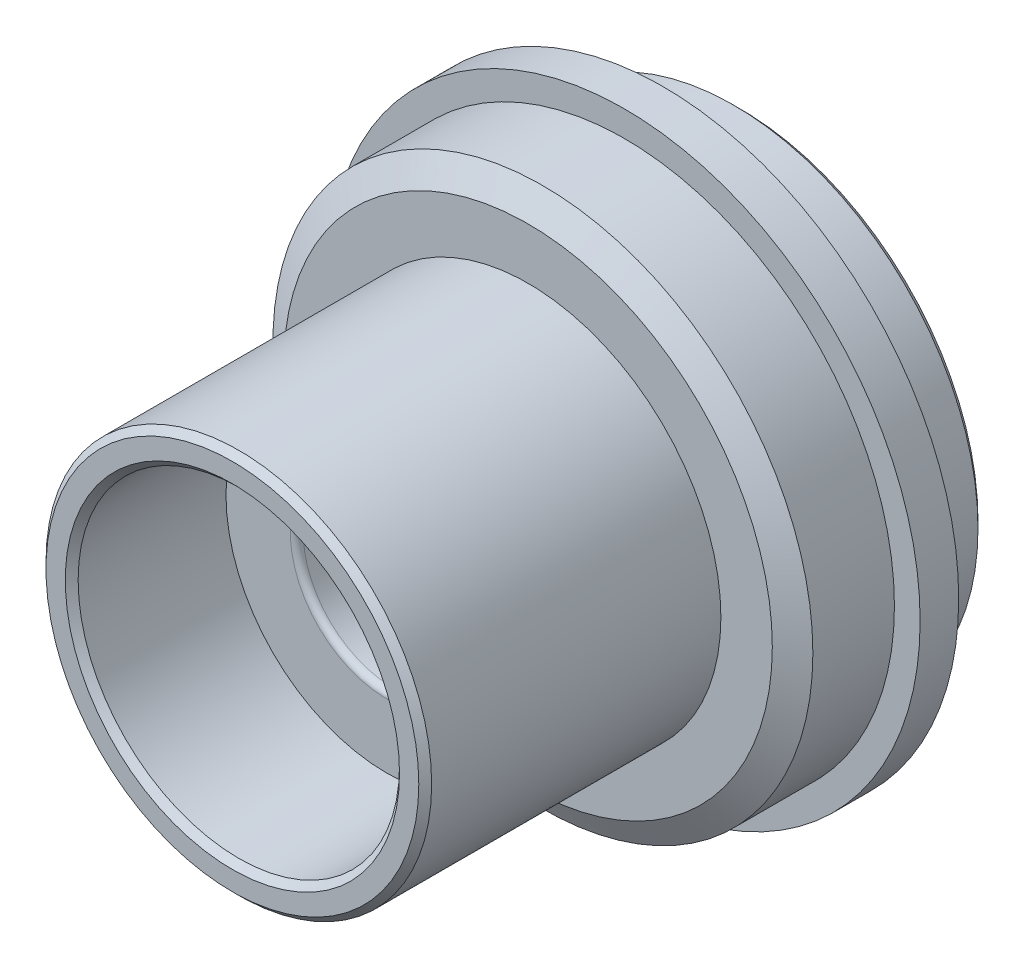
SolidWorks part; units mm, degrees
ref_plane "Plan1" through (0, 0, 0) normal (0, 0, 1) x (1, 0, 0)
ref_plane "Plan2" through (0, 0, 0) normal (0, 1, 0) x (1, 0, 0)
ref_plane "Plan3" through (0, 0, 0) normal (1, 0, 0) x (0, 0, -1)
sketch "Esquisse1" plane through (0, 0, 0) normal (0, 0, 1) x (1, 0, 0)
  circle A0 centre (0, 0) radius 19
  dimension "D1" = 38
extrude "Base-Extrusion" add sketch "Esquisse1" along normal blind 6
sketch "Esquisse2" plane through (0, 0, 6) normal (0, 0, 1) x (1, 0, 0)
  circle A0 centre (0, 0) radius 23
  dimension "D1" = 46
extrude "Boss.-Extru.1" add sketch "Esquisse2" along normal blind 3
sketch "Esquisse3" plane through (0, 0, 9) normal (0, 0, 1) x (1, 0, 0)
  circle A0 centre (0, 0) radius 21
  dimension "D1" = 42
extrude "Boss.-Extru.2" add sketch "Esquisse3" along normal blind 7.5
sketch "Esquisse4" plane through (0, 0, 16.5) normal (0, 0, 1) x (1, 0, 0)
  circle A0 centre (0, 0) radius 15
  dimension "D1" = 30
extrude "Boss.-Extru.3" add sketch "Esquisse4" along normal blind 23
sketch "Esquisse5" plane through (0, 0, 0) normal (0, 0, -1) x (-1, 0, 0)
  circle A0 centre (0, 0) radius 12
  dimension "D1" = 24
extrude "Enlèv. mat.-Extru.1" cut sketch "Esquisse5" against normal blind 13
sketch "Esquisse6" plane through (0, 0, 0) normal (1, 0, 0) x (0, 0, -1)
  line L0 (0, 0) -> (-15, 0) construction
  line L1 (-12, 11) -> (-12, 15)
  line L2 (-12, 15) -> (-4, 11)
  line L3 (-4, 11) -> (-12, 11)
revolve "Enlèvement de matière-Révolution1" cut sketch "Esquisse6" angle 360 about L0
sketch "Esquisse7" plane through (0, 0, 0) normal (0, 0, -1) x (-1, 0, 0)
  line L0 (0, 0) -> (0, 19) construction
  line L1 (-2.5, 14.3) -> (2.5, 14.3)
  line L2 (2.5, 14.3) -> (2.5, 9.55)
  line L3 (-2.5, 14.3) -> (-2.5, 9.55)
  line L4 (2.5, 9.55) -> (0, 9.5)
  line L5 (-2.5, 9.55) -> (0, 9.5)
  circle A0 centre (0, 0) radius 19 construction
  point P8 (0, 14.3)
  dimension "D1" = 5
  dimension "D2" = 14.3
extrude "Enlèv. mat.-Extru.2" cut sketch "Esquisse7" against normal blind 12
sketch "Esquisse8" plane through (0, 0, 39.5) normal (0, 0, 1) x (1, 0, 0)
  circle A0 centre (0, 0) radius 12.5
  dimension "D1" = 25
extrude "Enlèv. mat.-Extru.3" cut sketch "Esquisse8" against normal blind 12
sketch "Esquisse9" plane through (0, 0, 27.5) normal (0, 0, 1) x (1, 0, 0)
  circle A0 centre (0, 0) radius 7
  dimension "D1" = 14
extrude "Enlèv. mat.-Extru.4" cut sketch "Esquisse9" against normal through all
sketch "Esquisse10" plane through (0, 0, 0) normal (1, 0, 0) x (0, 0, -1)
  line L0 (0, 0) -> (-21.4343, 0) construction
  line L1 (-15.6, 9.3) -> (-19, 9.3)
  line L2 (-15.6, 9.3) -> (-15.6, 5.3)
  line L3 (-15.6, 5.3) -> (-19, 5.3)
  line L4 (-19, 9.3) -> (-19, 5.3)
  line L5 (-6, 0) -> (0, 0) construction
  dimension "D1" = 3.4
  dimension "D2" = 9.3
revolve "Enlèvement de matière-Révolution2" cut sketch "Esquisse10" angle 360 about L0
fillet "Congé1" radius 0.54
fillet "Congé2" radius 0.1
fillet "Congé3" radius 0.5
chamfer "Chanfrein1" distance 0.5 angle 45
chamfer "Chanfrein2" distance 2 angle 30
